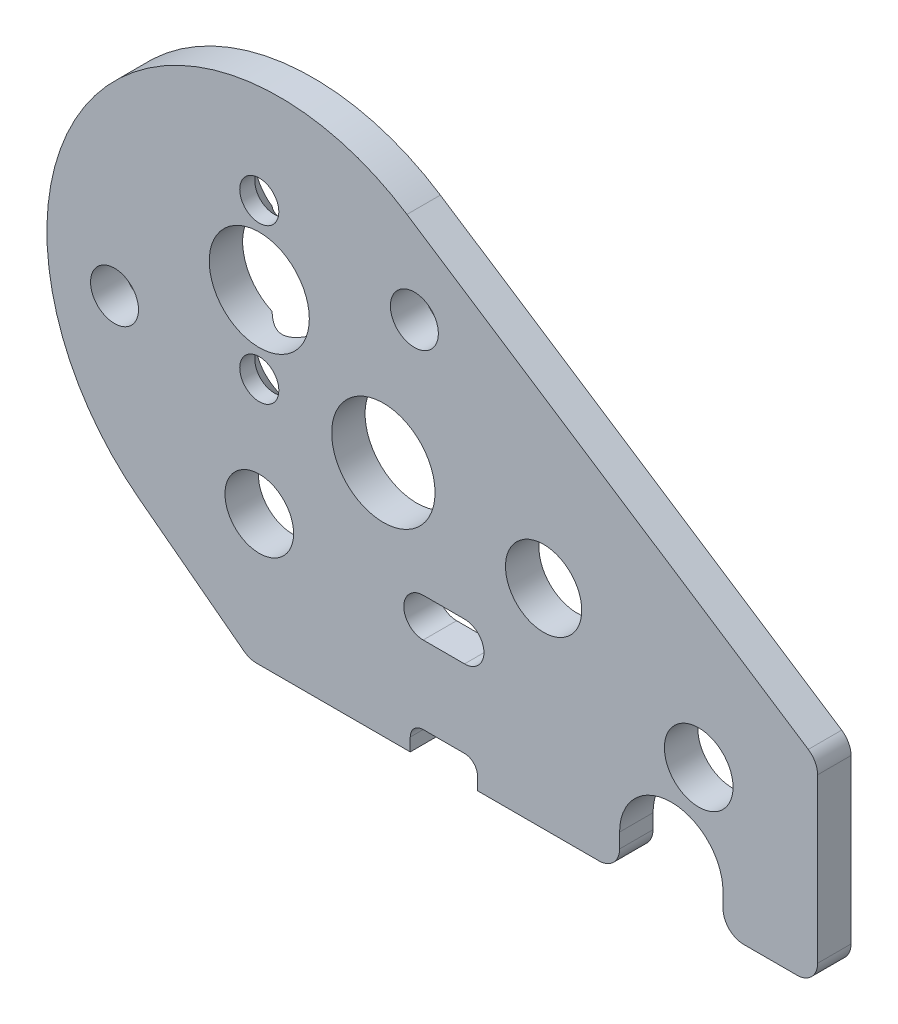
SolidWorks part; units mm, degrees
ref_plane "Front Plane" through (0, 0, 0) normal (0, 0, 1) x (1, 0, 0)
ref_plane "Top Plane" through (0, 0, 0) normal (0, 1, 0) x (1, 0, 0)
ref_plane "Right Plane" through (0, 0, 0) normal (1, 0, 0) x (0, 0, -1)
sketch "Sketch1" plane through (0, 0, 0) normal (0, 0, 1) x (1, 0, 0)
  line L0 (9.07, 8.5503) -> (34.29, -7.9595)
  line L1 (34.29, -19.939) -> (34.29, -7.9595)
  line L2 (34.29, -19.939) -> (-0.6022, -19.939)
  line L3 (0, 0) -> (1.2446, 0) construction
  line L4 (1.2446, 0) -> (1.2446, -3.4036) construction
  line L5 (-7.3936, -14.784) -> (-0.6022, -19.939)
  circle A0 centre (0, 0) radius 3.0734
  arc A1 (9.07, 8.5503) -> (-7.3936, -14.784) centre (1.2446, -3.4036) ccw
  circle A2 centre (17.4625, -7.1437) radius 2.341
  dimension "D1" = 6.1468
  dimension "D2" = 17.4625
  dimension "D7" = 14.2875
  dimension "D10" = 142.8
  dimension "D14" = 4.6821
  dimension "D3" = 7.1437
  dimension "D4" = 34.29
  dimension "D5" = 3.4036
  dimension "D6" = 1.2446
  dimension "D8" = 33.21
  dimension "D9" = 19.939
base flange "Base-Flange1" sketch "Sketch1" thickness 2.0523 reverse thickness direction no parameters "D1"=1.27
hole_wizard "CSK for M2 Flat Head Machine Screw1" positions "Sketch7" profile "Sketch6" countersink size "M2" standard "ANSI Metric"
sketch "Sketch7" plane through (0, 0, -2.0523) normal (0, 0, 1) x (1, 0, 0)
  line L0 (0, -4.7498) -> (0, 4.7498) construction
  line L1 (0, 0) -> (0, 15.3379) construction
  point P0 (0, 4.7498)
  point P2 (0, -4.7498)
  dimension "D1" = 9.4996
sketch "Sketch6" plane through (0, 4.7498, -2.0523) normal (1, 0, 0) x (0, 1, 0)
  line L0 (0, 0) -> (0, 2.0523)
  line L1 (0, 2.0523) -> (1.2, 2.0523)
  line L2 (1.2, 2.0523) -> (1.2, 1.127)
  line L3 (1.2, 1.127) -> (2.327, 0)
  line L5 (2.327, 0) -> (0, 0)
  line L6 (-1.2, 1.127) -> (-2.327, 0) construction
  line L11 (0, -6.35) -> (0, 107.95) construction
  dimension "Thru Hole Dia." = 2.4
  dimension "Thru Hole Depth" = 2.0523
  dimension "Near C'Sink Dia." = 4.654
  dimension "Near C'Sink Angle" = 90
hole_wizard "#19 (0.166) Diameter Hole1" positions "Sketch9" profile "Sketch8" hole size "#19" standard "ANSI Inch"
sketch "Sketch9" plane through (0, 0, 0) normal (0, 0, 1) x (1, 0, 0)
  line L0 (0, -11.9062) -> (26.9875, -11.9062) construction
  circle A0 centre (17.4625, -7.1437) radius 2.341 construction
  point P0 (0, -11.9062)
  point P2 (26.9875, -11.9062)
  dimension "D1" = 9.525
  dimension "D2" = 4.7625
  dimension "D3" = 17.4625
sketch "Sketch8" plane through (0, -11.9062, 0) normal (1, 0, 0) x (0, -1, 0)
  line L0 (0, 0) -> (0, 2.0523)
  line L1 (0, 2.0523) -> (2.1082, 2.0523)
  line L2 (2.1082, 2.0523) -> (2.1082, 0)
  line L5 (2.1082, 0) -> (0, 0)
  line L11 (0, -6.35) -> (0, 107.95) construction
  dimension "Thru Hole Dia." = 4.2164
  dimension "Thru Hole Depth" = 2.0523
hole_wizard "#4 Clearance Hole1" positions "Sketch11" profile "Sketch10" hole size "#4" standard "ANSI Inch"
sketch "Sketch11" plane through (0, 0, 0) normal (0, 0, 1) x (1, 0, 0)
  line L0 (0, 0) -> (9.525, 0) construction
  line L1 (9.525, 0) -> (9.525, 3.175) construction
  line L4 (0, 0) -> (-8.89, 0) construction
  line L5 (-8.89, 0) -> (-8.89, -4.7625) construction
  point P0 (9.525, 3.175)
  point P4 (-8.89, -4.7625)
  dimension "D1" = 3.175
  dimension "D2" = 9.525
  dimension "D3" = 8.89
  dimension "D4" = 4.7625
sketch "Sketch10" plane through (9.525, 3.175, 0) normal (1, 0, 0) x (0, -1, 0)
  line L0 (0, 0) -> (0, 2.0523)
  line L1 (0, 2.0523) -> (1.4732, 2.0523)
  line L2 (1.4732, 2.0523) -> (1.4732, 0)
  line L5 (1.4732, 0) -> (0, 0)
  line L11 (0, -6.35) -> (0, 107.95) construction
  dimension "Thru Hole Dia." = 2.9464
  dimension "Thru Hole Depth" = 2.0523
sketch "Sketch12" plane through (0, 0, 0) normal (0, 0, 1) x (1, 0, 0)
  line L0 (7.62, -5.3848) -> (25.3055, -17.7683) construction
  line L1 (25.3055, -17.7683) -> (-9.1216, -17.7683) construction
  line L2 (22.1305, -17.7683) -> (22.1305, -19.939)
  line L3 (-0.6022, -19.939) -> (34.29, -19.939) construction
  line L4 (22.1305, -19.939) -> (28.4805, -19.939)
  line L5 (28.4805, -17.7683) -> (28.4805, -19.939)
  circle A0 centre (7.62, -5.3848) radius 3.175
  arc A1 (28.4805, -17.7683) -> (22.1305, -17.7683) centre (25.3055, -17.7683) ccw
  dimension "D1" = 6.35
  dimension "D2" = 7.62
  dimension "D6" = 3.175
  dimension "D3" = 5.3848
  dimension "D4" = 35
  dimension "D5" = 21.59
extrude "Cut-Extrude1" cut sketch "Sketch12" against normal through all
fillet "Fillet2" radius 1.27 5 edges at (34.29, -7.9595, -1.0262) (-0.6022, -19.939, -1.0262) (22.1305, -19.939, -1.0262) (28.4805, -19.939, -1.0262) (34.29, -19.939, -1.0262)
sketch "Sketch13" plane through (0, 0, -2.0523) normal (0, 0, -1) x (-1, 0, 0)
  line L0 (-12.6055, -12.3984) -> (-10.0655, -12.3984) construction
  line L1 (-12.6055, -11.2078) -> (-10.0655, -11.2078)
  line L2 (-12.6055, -13.589) -> (-10.0655, -13.589)
  line L3 (0.1748, -19.939) -> (-20.8605, -19.939) construction
  line L4 (-12.6055, -19.1453) -> (-12.6055, -12.3984) construction
  line L5 (-10.0655, -19.1453) -> (-10.0655, -12.3984) construction
  line L6 (0.1748, -19.939) -> (-20.8605, -19.939) construction
  line L7 (-22.1305, -17.7683) -> (-22.1305, -18.669) construction
  line L9 (-13.3992, -19.939) -> (-9.2717, -19.939)
  line L10 (-13.3992, -19.939) -> (-13.3992, -19.1453)
  line L11 (-12.6055, -18.3515) -> (-10.0655, -18.3515)
  line L12 (-9.2717, -19.939) -> (-9.2717, -19.1453)
  arc A0 (-12.6055, -11.2078) -> (-12.6055, -13.589) centre (-12.6055, -12.3984) ccw
  arc A1 (-10.0655, -13.589) -> (-10.0655, -11.2078) centre (-10.0655, -12.3984) ccw
  arc A2 (-10.0655, -18.3515) -> (-9.2717, -19.1453) centre (-10.0655, -19.1453) cw
  arc A3 (-13.3992, -19.1453) -> (-12.6055, -18.3515) centre (-12.6055, -19.1453) cw
  point P2 (-11.3355, -12.3984)
  dimension "D1" = 2.3813
  dimension "D4" = 0.7937
  dimension "D2" = 2.54
  dimension "D3" = 1.5875
  dimension "D5" = 9.525
  dimension "D6" = 4.7625
extrude "Cut-Extrude2" cut sketch "Sketch13" against normal through all
surface "Oberfläche-Offset1" [suppressed] parameters "D1"=0
delete or keep bodies "Körper-Löschen/beibehalten 1" [suppressed] type delete bodies bodies 108
thicken "Wanddicke auftragen1" [suppressed] surfaces to thicken 109 thickness 0.001 parameters "D1"=0.001
sketch "Bend-Lines1" [suppressed] plane through (0, 0, 0) normal (0, 1, 0) x (1, 0, 0)
sketch "Bounding-Box1" [suppressed] plane through (0, 0, 0) normal (0, 1, 0) x (1, 0, 0)
sheet metal parameters "Sheet-Metal1" thickness 2.0523 parameters "D1"=1.27
flat pattern "Flat-Pattern1"
sketch "Bend-Lines2" plane through (0, 0, 0) normal (0, 1, 0) x (1, 0, 0)
sketch3d "Bounding-Box2" [suppressed]
  line L0 (-9.4747, 9.5749, 0) -> (-9.5747, -9.4748, 0) construction
  line L1 (9.5748, 9.4749, 0) -> (9.4748, -9.5748, 0) construction
  line L2 (-9.4747, 9.5749, 0) -> (9.5748, 9.4749, 0) construction
  line L3 (-9.5747, -9.4748, 0) -> (9.4748, -9.5748, 0) construction
sheet metal parameters "Sheet-Metal2" thickness 2.0523 parameters "D1"=1.27
flat pattern "Flat-Pattern1"
sketch "Bend-Lines2" plane through (0, 0, 0) normal (0, 1, 0) x (1, 0, 0)
sketch3d "Bounding-Box2" [suppressed]
  line L0 (-14.2875, -9.3878, 0) -> (30.6349, -9.3878, 0) construction
  line L1 (-14.2875, 14.2875, 0) -> (30.6349, 14.2875, 0) construction
  line L2 (-14.2875, -9.3878, 0) -> (-14.2875, 14.2875, 0) construction
  line L3 (30.6349, -9.3878, 0) -> (30.6349, 14.2875, 0) construction
sheet metal parameters "Sheet-Metal3" thickness 2.0523 parameters "D1"=1.27
flat pattern "Flat-Pattern1"
sketch "Bend-Lines2" plane through (0, 0, 0) normal (0, 1, 0) x (1, 0, 0)
sketch3d "Bounding-Box2" [suppressed]
  line L0 (-14.2875, -9.3878, 0) -> (30.6349, -9.3878, 0) construction
  line L1 (-14.2875, 14.2875, 0) -> (30.6349, 14.2875, 0) construction
  line L2 (-14.2875, -9.3878, 0) -> (-14.2875, 14.2875, 0) construction
  line L3 (30.6349, -9.3878, 0) -> (30.6349, 14.2875, 0) construction
sheet metal parameters "Sheet-Metal4" thickness 2.0523 parameters "D1"=1.27
flat pattern "Flat-Pattern1"
sketch "Bend-Lines2" plane through (0, 0, 0) normal (0, 1, 0) x (1, 0, 0)
sketch3d "Bounding-Box2" [suppressed]
  line L0 (-14.2875, -12.5628, 0) -> (30.6349, -12.5628, 0) construction
  line L1 (-14.2875, 14.2875, 0) -> (30.6349, 14.2875, 0) construction
  line L2 (-14.2875, -12.5628, 0) -> (-14.2875, 14.2875, 0) construction
  line L3 (30.6349, -12.5628, 0) -> (30.6349, 14.2875, 0) construction
sheet metal parameters "Sheet-Metal6" thickness 2.0523 parameters "D1"=1.27
flat pattern "Flat-Pattern1"
sketch "Bend-Lines2" plane through (0, 0, 0) normal (0, 1, 0) x (1, 0, 0)
sketch3d "Bounding-Box2" [suppressed]
  line L0 (-14.2875, -16.6268, 0) -> (33.1749, -16.6268, 0) construction
  line L1 (-14.2875, 14.2875, 0) -> (33.1749, 14.2875, 0) construction
  line L2 (-14.2875, -16.6268, 0) -> (-14.2875, 14.2875, 0) construction
  line L3 (33.1749, -16.6268, 0) -> (33.1749, 14.2875, 0) construction
sheet metal parameters "Sheet-Metal8" thickness 2.0523 parameters "D1"=1.27
flat pattern "Flat-Pattern1"
sketch "Bend-Lines2" plane through (0, 0, 0) normal (0, 1, 0) x (1, 0, 0)
sketch3d "Bounding-Box2" [suppressed]
  line L0 (-14.2875, 14.2875, 0) -> (33.0454, 14.2875, 0) construction
  line L1 (-14.2875, -16.5354, 0) -> (33.0454, -16.5354, 0) construction
  line L2 (-14.2875, 14.2875, 0) -> (-14.2875, -16.5354, 0) construction
  line L3 (33.0454, 14.2875, 0) -> (33.0454, -16.5354, 0) construction
